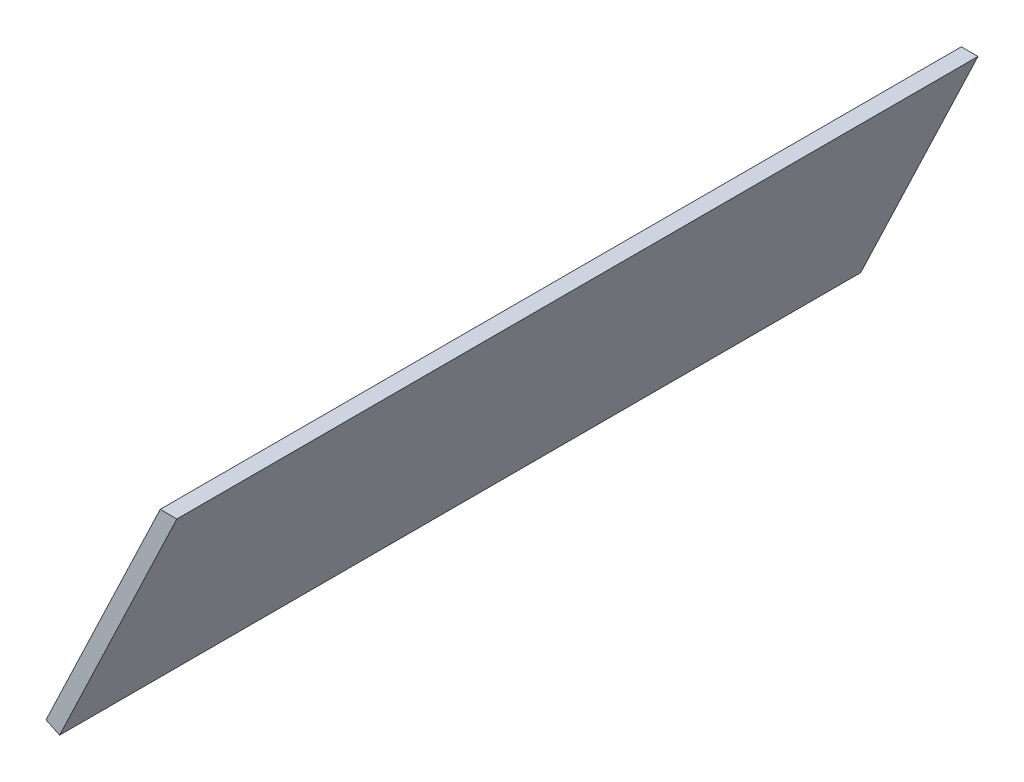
SolidWorks part; units mm, degrees
ref_plane "Front Plane" through (0, 0, 0) normal (0, 0, 1) x (1, 0, 0)
ref_plane "Top Plane" through (0, 0, 0) normal (0, 1, 0) x (1, 0, 0)
ref_plane "Right Plane" through (0, 0, 0) normal (1, 0, 0) x (0, 0, -1)
ref_plane "Front Plane-Bucket_Floor" through (0, 0, 0) normal (0, 0, 1) x (1, 0, 0)
ref_plane "Top Plane-Bucket_Floor" through (0, 0, 0) normal (0, 1, 0) x (1, 0, 0)
ref_plane "Right Plane-Bucket_Floor" through (0, 0, 0) normal (1, 0, 0) x (0, 0, -1)
sketch "Sketch1-Bucket_Floor" plane through (0, 0, 0) normal (0, 0, 1) x (1, 0, 0)
  line L0 (-50.546, 21.0608) -> (-72.8591, 67.8392)
  line L1 (50.546, -21.0608) -> (-50.546, -21.0608)
  line L2 (50.546, -21.0608) -> (50.546, 21.0608)
  line L4 (-50.546, -21.0608) -> (-50.546, 21.0608)
  line L5 (50.546, -21.0608) -> (-50.546, 21.0608) construction
  line L6 (50.546, 21.0608) -> (-50.546, -21.0608) construction
  line L7 (-72.8591, 67.8392) -> (72.8591, 67.8392)
  line L8 (72.8591, 67.8392) -> (50.546, 21.0608)
  point P0 (0, 0)
  dimension "D1" = 101.092
  dimension "D2" = 88.9
  dimension "D3" = 205.501
  dimension "D4" = 42.1217
inserted part "Bucket_Floor"
sketch "Sketch2" plane through (0, 0, 0) normal (0, 0, 1) x (1, 0, 0)
  line L0 (72.8591, 67.8392) -> (50.546, 21.0608)
  line L1 (50.546, 21.0608) -> (47.9595, 22.2946)
  line L2 (47.9595, 22.2946) -> (69.6841, 67.8392)
  line L3 (-72.8591, 67.8392) -> (72.8591, 67.8392) construction
  line L4 (69.6841, 67.8392) -> (72.8591, 67.8392)
  dimension "D1" = 3.175
extrude "Boss-Extrude1" add sketch "Sketch2" along normal blind 152.4
